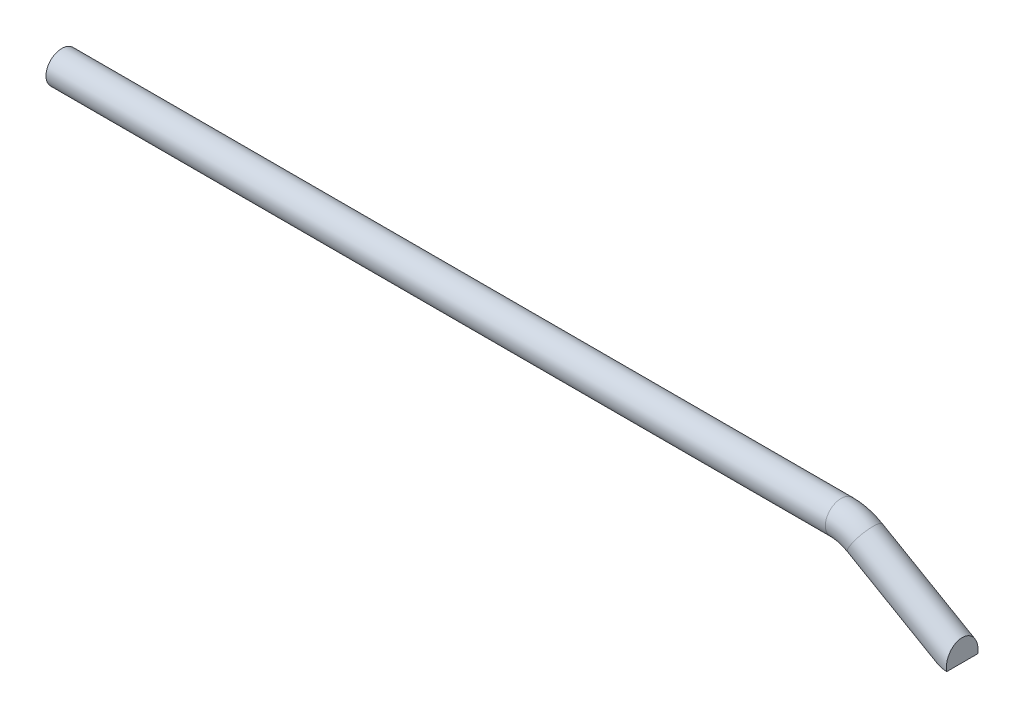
SolidWorks part; units mm, degrees
ref_plane "Plan de face" through (0, 0, 0) normal (0, 0, 1) x (1, 0, 0)
ref_plane "Plan de dessus" through (0, 0, 0) normal (0, 1, 0) x (1, 0, 0)
ref_plane "Plan de droite" through (0, 0, 0) normal (1, 0, 0) x (0, 0, -1)
sketch "Esquisse1" plane through (0, 0, 0) normal (0, 0, 1) x (1, 0, 0)
  line L0 (0, 0) -> (295.1769, 0)
  line L1 (304.1769, -2.4115) -> (350, -28.8675)
  arc A0 (304.1769, -2.4115) -> (295.1769, 0) centre (295.1769, -18) ccw
  point P6 (300, 0)
  dimension "D4" = 18
  dimension "D1" = 300
  dimension "D2" = 30
  dimension "D3" = 350
sketch "Esquisse2" plane through (0, 0, 0) normal (1, 0, 0) x (0, 0, -1)
  circle A0 centre (0, 0) radius 6
  dimension "D1" = 12
sweep "Balayage1" add profiles "Esquisse2" path "Esquisse1"
sketch "Esquisse3" plane through (0, 0, 0) normal (0, 0, 1) x (1, 0, 0)
  line L0 (341, -25) -> (341, -16.7432)
  line L2 (341, -16.7432) -> (353, -23.6714)
  line L3 (353, -23.6714) -> (347, -34.0637)
  line L4 (331.3013, -25) -> (341, -25)
  line L5 (301.1769, -7.6077) -> (347, -34.0637) construction
  line L6 (331.3013, -25) -> (347, -34.0637)
  line L8 (0, -6) -> (295.1769, -6) construction
  dimension "D1" = 19
  dimension "D2" = 12
extrude "Enlèv. mat.-Extru.1" cut sketch "Esquisse3" against normal mid plane 20
